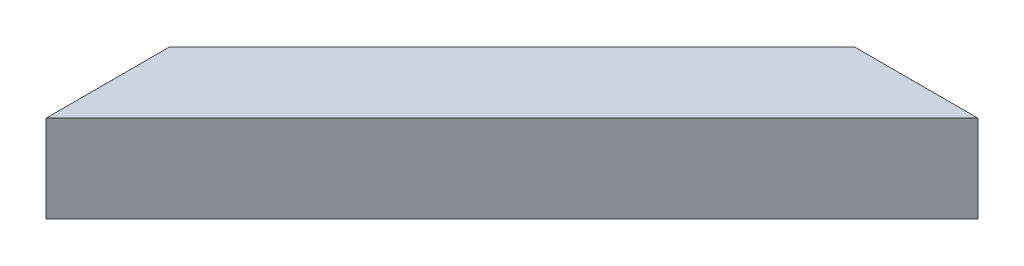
SolidWorks part; units mm, degrees
ref_plane "前视基准面" through (0, 0, 0) normal (0, 0, 1) x (1, 0, 0)
ref_plane "上视基准面" through (0, 0, 0) normal (0, 1, 0) x (1, 0, 0)
ref_plane "右视基准面" through (0, 0, 0) normal (1, 0, 0) x (0, 0, -1)
other "Configuration Table"
sketch "草图1" plane through (0, 0, 0) normal (0, 1, 0) x (1, 0, 0)
  line L0 (-160, -160) -> (160, 160)
  line L1 (-160, 160) -> (160, 160)
  line L2 (-160, 160) -> (-160, -160)
  line L3 (-160, -160) -> (160, -160)
  line L4 (160, 160) -> (160, -160)
  line L5 (-160, 160) -> (160, -160) construction
  line L6 (-160, -160) -> (160, 160) construction
  line L7 (0, 0) -> (106.5059, -106.5059) construction
  line L8 (0, 0) -> (-42.4264, 42.4264)
  line L9 (-160, -75.1472) -> (75.1472, 160)
  point P0 (0, 0)
  point P11 (106.5059, -106.5059)
  point P13 (-42.4264, 42.4264)
  point P14 (-42.4264, 42.4264)
  point P15 (-42.4264, 42.4264)
extrude "凸台-拉伸1" add sketch "草图1" along normal blind 60
